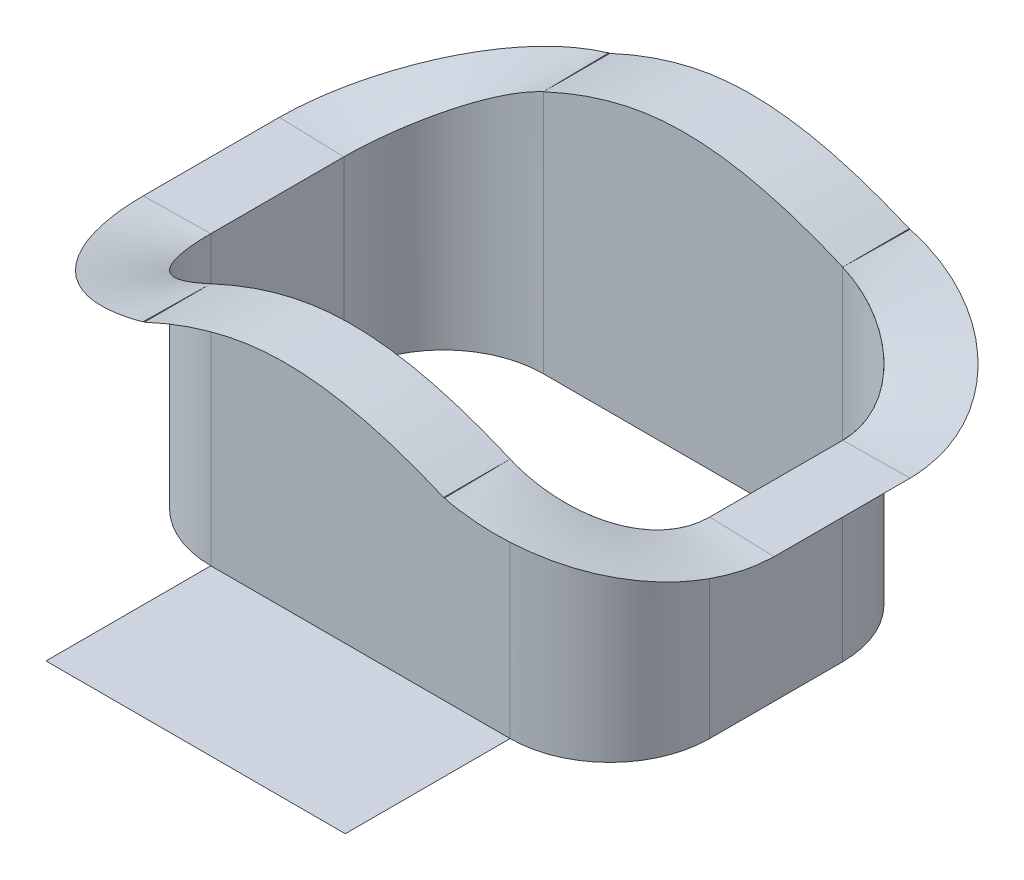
SolidWorks part; units mm, degrees
ref_plane "Front" through (0, 0, 0) normal (0, 0, 1) x (1, 0, 0)
ref_plane "Top" through (0, 0, 0) normal (0, 1, 0) x (1, 0, 0)
ref_plane "Right" through (0, 0, 0) normal (1, 0, 0) x (0, 0, -1)
sketch "Sketch2" plane through (0, 0, 0) normal (0, 1, 0) x (1, 0, 0)
  line L0 (75, -50) -> (-75, 50) construction
  line L1 (-75, 50) -> (75, 50)
  line L2 (-75, 50) -> (-75, -50)
  line L3 (-75, -50) -> (75, -50)
  line L4 (75, 50) -> (75, -50)
  dimension "D1" = 150
  dimension "D2" = 100
surface "Surface-Extrude1" sketch "Sketch2" parameters "D1"=139.5565
fillet "Fillet1" radius 30
sketch "Sketch3" plane through (0, 0, 50) normal (0, 0, 1) x (1, 0, 0)
  spline_without_curve S0
surface "Surface-Trim2"
sketch "Sketch6" plane through (0, 0, 50) normal (0, 0, 1) x (1, 0, 0)
  line L0 (-45, 0) -> (45, 0) construction
  line L1 (-45, 0) -> (45, 0)
surface "Surface-Extrude2" sketch "Sketch6" parameters "D1"=49.5565
surface "Surface-Radiate10" parameters "D1"=20
